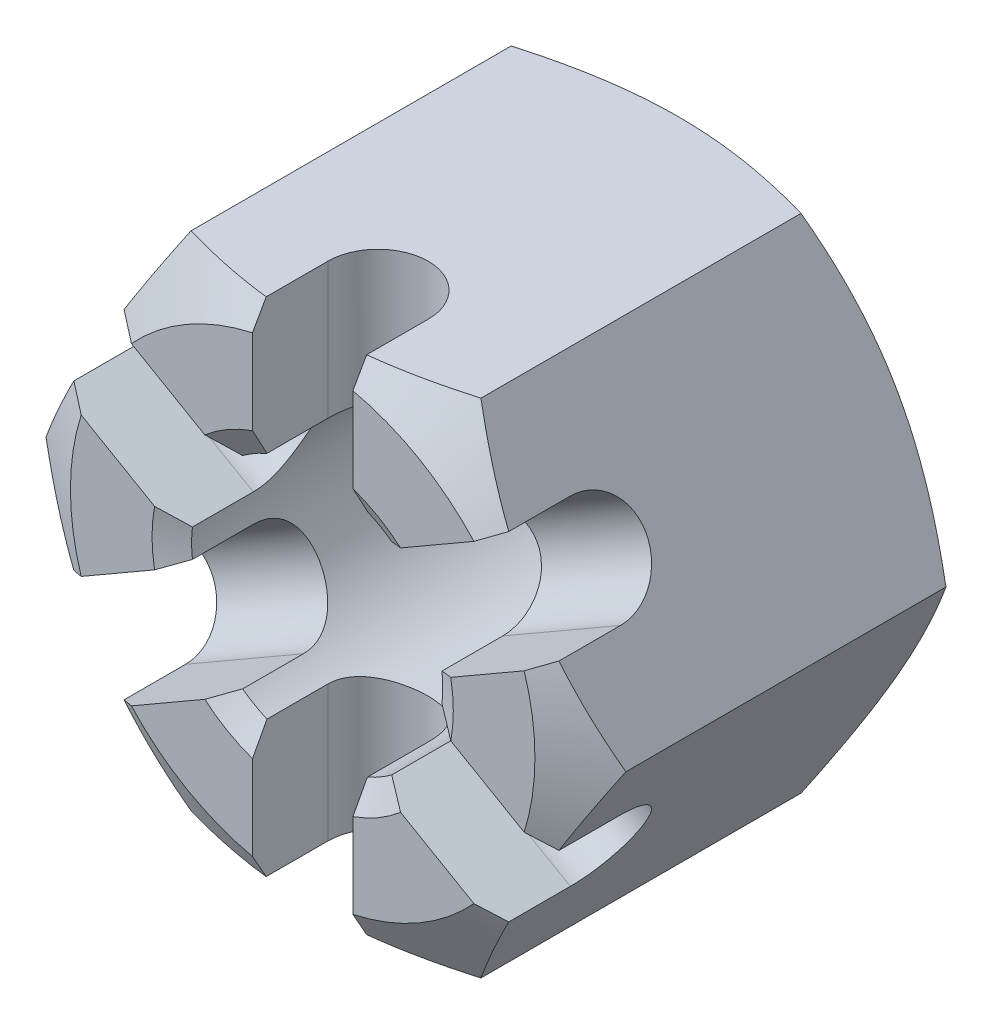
SolidWorks part; units mm, degrees
ref_plane "Front" through (0, 0, 0) normal (0, 0, 1) x (1, 0, 0)
ref_plane "Top" through (0, 0, 0) normal (0, 1, 0) x (1, 0, 0)
ref_plane "Right" through (0, 0, 0) normal (1, 0, 0) x (0, 0, -1)
other "Configuration Table"
sketch "Sketch1" plane through (0, 0, 0) normal (0, 0, 1) x (1, 0, 0)
  line L1 (2.8868, -5) -> (5.7735, 0)
  line L2 (5.7735, 0) -> (2.8868, 5)
  line L3 (2.8868, 5) -> (-2.8868, 5)
  line L4 (-2.8868, 5) -> (-5.7735, 0)
  line L5 (-5.7735, 0) -> (-2.8868, -5)
  line L6 (-2.8868, -5) -> (2.8868, -5)
  circle A0 centre (0, 0) radius 5 construction
  circle A1 centre (0, 0) radius 2.5
extrude "BaseNut" add sketch "Sketch1" against normal blind 7.7
sketch "Sketch2" plane through (0, 0, 0) normal (0, 1, 0) x (1, 0, 0)
  line L0 (-5.7735, 7.7) -> (-4.625, 7.7)
  line L2 (-4.625, 7.7) -> (-5.7735, 7.0369)
  line L3 (-5.7735, 7.0369) -> (-5.7735, 7.7)
  line L4 (0, 3.3759) -> (0, -9.8171) construction
  line L6 (-9.7712, 3.85) -> (9.8853, 3.85) construction
  line L7 (-5.7735, 0.6631) -> (-5.7735, 0)
  line L8 (-4.625, 0) -> (-5.7735, 0.6631)
  line L9 (-5.7735, 0) -> (-4.625, 0)
revolve "Double-Chamfer" cut sketch "Sketch2" angle 360 about L4
chamfer "EndChamfer" distance 0.5 angle 30 2 edges at (2.5, 0, -7.7) (2.5, 0, 0)
sketch "Sketch3" plane through (0, 0, 0) normal (0, 1, 0) x (1, 0, 0)
  line L0 (0, 4.2201) -> (0, -10.5237) construction
  line L2 (-1, 0) -> (-1, 1.5)
  line L3 (1, 0) -> (1, 1.5)
  line L4 (2.7887, 7.7) -> (-2.7887, 7.7) construction
  arc A0 (-1, 1.5) -> (1, 1.5) centre (0, 1.5) cw
  point P2 (0, 2.5)
  point P3 (0, 7.7)
extrude "Slot" cut sketch "Sketch3" against normal through all and the other way through all
pattern_circular "SlotPattern" count 3 over 360 about axis through (0, 0, -3.3759) along (0, 0, 1) of "Slot"
sketch "Sketch4" plane through (0, 0, 0) normal (0, 1, 0) x (1, 0, 0)
  line L0 (4.625, 0) -> (4.625, 2.5)
  line L2 (4.625, 2.5) -> (5.7735, 3.1631)
  line L4 (4.625, 0) -> (5.7735, 0)
  line L5 (5.7735, 0) -> (5.7735, 3.1631)
  line L7 (0, -0.375) -> (0, -8.8366) construction
  line L19 (4.4106, 0) -> (4.625, 0) construction
  line L20 (5.7735, 7.0369) -> (5.7735, 0.6631) construction
revolve "Cut-Revolve1" [suppressed] cut sketch "Sketch4" angle 360 about L7
sketch "Sketch5" plane through (0, 0, 0) normal (0, 1, 0) x (1, 0, 0)
  line L0 (0, 8.5981) -> (0, -0.494) construction
  line L1 (-2.5, 7.95) -> (-2.933, 7.7)
  line L2 (-2.933, 7.7) -> (-2.5, 7.45)
  line L3 (-2.5, 7.45) -> (-2, 7.45)
  line L4 (-2, 7.45) -> (-2, 7.95)
  line L5 (-2, 7.95) -> (-2.5, 7.95)
revolve "Cut-Revolve10" [suppressed] cut sketch "Sketch5" angle 360 about L0
pattern_linear "LPattern10" [suppressed] count 13 spacing 0.6 along (0, 0, 1)
equation "\"dw@Sketch2\" = \"s@Sketch1\"-0.75"
equation "\"de@Sketch4\" = \"dw@Sketch2\""
equation "\"D1@Sketch3\" = \"m@BaseNut\" - \"W@Sketch3\""
equation "\"D2@Sketch2\" = \"m@BaseNut\" / 2"
equation "\"W@Sketch4\" = \"W@Sketch3\""
equation "\"D2@Sketch5\"=\"D@Sketch1\""
equation "\"D1@Sketch5\"= ( \"D@ThreadCosmetic1\"-\"D2@Sketch5\" )  / 2"
equation "\"D3@LPattern10\" = \"D1@Sketch5\" * 1.2"
equation "\"D1@LPattern10\" = \"m@BaseNut\" / \"D3@LPattern10\""
equation "\"D1@EndChamfer\"=\"D@Sketch1\" / 10"
